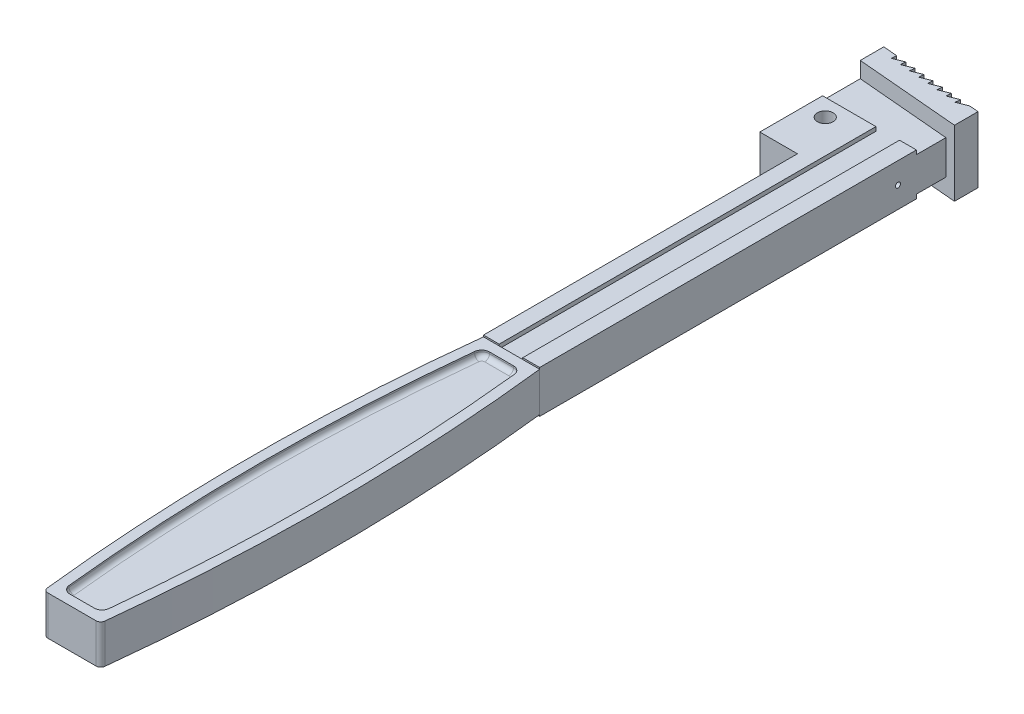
SolidWorks part; units mm, degrees
ref_plane "Front" through (0, 0, 0) normal (0, 0, 1) x (1, 0, 0)
ref_plane "Top" through (0, 0, 0) normal (0, 1, 0) x (1, 0, 0)
ref_plane "Right" through (0, 0, 0) normal (1, 0, 0) x (0, 0, -1)
sketch "Sketch1" plane through (0, 0, 0) normal (0, 1, 0) x (1, 0, 0)
  line L0 (-9, 0) -> (9, 0)
  line L1 (-8.9429, 140) -> (-8.9429, 240)
  line L2 (-8.9429, 140) -> (8.9429, 140) construction
  line L3 (-8.9429, 240) -> (-20.9429, 240)
  line L4 (-20.9429, 240) -> (-20.9429, 272)
  line L5 (-20.9429, 272) -> (8.9429, 269.3853)
  line L6 (8.9429, 269.3853) -> (8.9429, 140)
  arc A0 (-8.9429, 140) -> (-9, 0) centre (609.077, 69.748) ccw
  arc A1 (8.9429, 140) -> (9, 0) centre (-609.077, 69.748) cw
  point P3 (0, 140)
  dimension "D4" = 622
  dimension "D1" = 18
  dimension "D3" = 140
  dimension "D5" = 85
  dimension "D6" = 100
  dimension "D7" = 12
  dimension "D8" = 32
  dimension "D9" = 30
extrude "Boss-Extrude1" add sketch "Sketch1" along normal mid plane 12.5
sketch "Sketch2" plane through (0, 0, 0) normal (0, 1, 0) x (1, 0, 0)
  line L0 (-20.9429, 279.5) -> (11.9315, 276.6239)
  line L1 (-20.9429, 272) -> (-20.9429, 279.5)
  line L2 (11.9315, 276.6239) -> (11.9315, 269.1239)
  line L3 (-20.9429, 272) -> (11.9315, 269.1239)
  line L6 (-9, 0) -> (9, 0)
  line L7 (8.9429, 140) -> (8.9429, 269.3853)
  line L8 (8.9429, 269.3853) -> (-20.9429, 272)
  line L9 (-20.9429, 272) -> (-20.9429, 240)
  line L10 (-20.9429, 240) -> (-8.9429, 240)
  line L11 (-8.9429, 240) -> (-8.9429, 140)
  line L12 (-9, 0) -> (9, 0) construction
  line L13 (8.9429, 140) -> (8.9429, 269.3853) construction
  line L14 (8.9429, 269.3853) -> (-20.9429, 272) construction
  line L15 (-20.9429, 272) -> (-20.9429, 240) construction
  line L16 (-20.9429, 240) -> (-8.9429, 240) construction
  line L17 (-8.9429, 240) -> (-8.9429, 140) construction
  arc A2 (-8.9429, 140) -> (-9, 0) centre (609.077, 69.748) ccw
  arc A3 (9, 0) -> (8.9429, 140) centre (-609.077, 69.748) ccw
  arc A4 (-8.9429, 140) -> (-9, 0) centre (609.077, 69.748) ccw construction
  arc A5 (9, 0) -> (8.9429, 140) centre (-609.077, 69.748) ccw construction
  dimension "D2" = 33
  dimension "D3" = 7.5
  dimension "D1" = 0
extrude "Boss-Extrude2" add sketch "Sketch2" along normal mid plane 21
sketch "Sketch3" plane through (0, 10.5, 0) normal (0, 1, 0) x (1, 0, 0)
  line L0 (-16.46, 279.1078) -> (-16.5995, 277.5137)
  line L1 (11.9315, 276.6239) -> (-20.9429, 279.5) construction
  line L2 (-16.5995, 277.5137) -> (-13.2722, 278.8289)
  line L3 (-13.2722, 278.8289) -> (-16.46, 279.1078)
  dimension "D1" = 4.5
  dimension "D2" = 3.2
  dimension "D3" = 1.6002
extrude "Cut-Extrude1" cut sketch "Sketch3" against normal through all
pattern_linear "LPattern1" count 8 spacing 3.2 along (0.9962, 0, 0.0872) of "Cut-Extrude1"
sketch "Sketch4" plane through (0, 6.25, 0) normal (0, 1, 0) x (1, 0, 0)
  line L0 (-20.9429, 260) -> (8.9429, 260)
  line L1 (-20.9429, 272) -> (8.9429, 269.3853)
  line L2 (-20.9429, 272) -> (11.9315, 269.1239) construction
  line L3 (-20.9429, 240) -> (-8.9429, 240) construction
  line L4 (-20.9429, 272) -> (-20.9429, 260)
  line L5 (-20.9429, 272) -> (-20.9429, 240) construction
  line L6 (8.9429, 269.3853) -> (8.9429, 260)
  line L8 (8.9429, 140) -> (8.9429, 269.3853) construction
  dimension "D1" = 20
extrude "Cut-Extrude2" cut sketch "Sketch4" against normal blind 0.8
sketch "Sketch6" plane through (0, 6.25, 0) normal (0, 1, 0) x (1, 0, 0)
  line L0 (-8.9429, 140) -> (8.9429, 140) construction
  line L1 (3.5571, 260) -> (3.5571, 140)
  line L2 (-20.9429, 260) -> (8.9429, 260) construction
  line L3 (-3.9429, 260) -> (-3.9429, 140)
  line L4 (-3.9429, 260) -> (3.5571, 260)
  line L5 (-3.9429, 140) -> (3.5571, 140)
  line L6 (-8.9429, 240) -> (-8.9429, 140) construction
  dimension "D1" = 5
  dimension "D2" = 7.5
extrude "Cut-Extrude3" cut sketch "Sketch6" against normal blind 0.8
sketch "Sketch7" plane through (0, 6.25, 0) normal (0, 1, 0) x (1, 0, 0)
  line L7 (-6.1342, 3.2) -> (6.1342, 3.2)
  line L8 (-6.1342, 3.2) -> (6.1342, 3.2)
  line L10 (-3.9429, 136.8) -> (3.5571, 136.8)
  line L11 (-6.0794, 136.8) -> (6.0794, 136.8)
  arc A9 (6.1342, 3.2) -> (5.7634, 139.6386) centre (-609.077, 69.748) ccw
  arc A10 (-5.7634, 139.6386) -> (-6.1342, 3.2) centre (609.077, 69.748) ccw
  arc A11 (6.1342, 3.2) -> (6.0794, 136.8) centre (-609.077, 69.748) ccw
  arc A12 (-6.0794, 136.8) -> (-6.1342, 3.2) centre (609.077, 69.748) ccw
  dimension "D1" = 3.2
  dimension "D2" = 3.2
extrude "Cut-Extrude4" cut sketch "Sketch7" against normal blind 2
sketch "Sketch8" plane through (0, 6.25, 0) normal (0, 1, 0) x (1, 0, 0)
  line L0 (-8.9429, 140) -> (-3.9429, 140)
  line L1 (3.5571, 140) -> (8.9429, 140)
  line L10 (3.5571, 260) -> (3.5571, 140)
  line L11 (3.5571, 140) -> (-3.9429, 140)
  line L12 (-3.9429, 140) -> (-3.9429, 260)
  line L13 (-3.9429, 260) -> (-20.9429, 260)
  line L14 (-20.9429, 260) -> (-20.9429, 240)
  line L15 (-20.9429, 240) -> (-8.9429, 240)
  line L16 (-8.9429, 240) -> (-8.9429, 140)
  line L17 (-9, 0) -> (9, 0)
  line L18 (8.9429, 140) -> (8.9429, 260)
  line L19 (8.9429, 260) -> (3.5571, 260)
  line L20 (3.5571, 260) -> (3.5571, 140)
  line L22 (-3.9429, 140) -> (-3.9429, 260)
  line L23 (-3.9429, 260) -> (-20.9429, 260)
  line L24 (-20.9429, 260) -> (-20.9429, 240)
  line L25 (-20.9429, 240) -> (-8.9429, 240)
  line L26 (-8.9429, 240) -> (-8.9429, 140)
  line L28 (8.9429, 140) -> (8.9429, 260)
  line L29 (8.9429, 260) -> (3.5571, 260)
  arc A2 (-8.9429, 140) -> (-9, 0) centre (609.077, 69.748) ccw
  arc A3 (9, 0) -> (8.9429, 140) centre (-609.077, 69.748) ccw
  dimension "D1" = 0
extrude "Boss-Extrude3" add sketch "Sketch8" along normal blind 0.5
mirror "Mirror1" about plane through (0, 0, 0) normal (0, 1, 0) of "Cut-Extrude2", "Cut-Extrude3", "Cut-Extrude4", "Boss-Extrude3"
fillet "Fillet1" radius 2.5 4 edges at (6.1342, 5.25, -3.2) (6.0794, 5.25, -136.8) (-6.1342, 5.25, -3.2) (-6.0794, 5.25, -136.8)
fillet "Fillet2" radius 2.5 4 edges at (-6.0794, -5.25, -136.8) (6.1342, -5.25, -3.2) (-6.1342, -5.25, -3.2) (6.0794, -5.25, -136.8)
sketch "Sketch9" plane through (0, 6.75, 0) normal (0, 1, 0) x (1, 0, 0)
  line L0 (-20.9429, 260) -> (-20.9429, 240) construction
  line L1 (-20.9429, 260) -> (-3.9429, 260) construction
  circle A0 centre (-14.5929, 254.5) radius 2.5
  dimension "D1" = 5
  dimension "D2" = 6.35
  dimension "D3" = 5.5
extrude "Cut-Extrude5" cut sketch "Sketch9" against normal through all
sketch "Sketch10" plane through (8.9429, 0, 0) normal (1, 0, 0) x (0, 0, -1)
  line L0 (269.1239, 10.5) -> (269.1239, -10.5) construction
  circle A0 centre (254.1239, 0) radius 1
  dimension "D1" = 2
  dimension "D2" = 15
fillet "Fillet3" radius 1.5 16 edges at (-5.5056, 4.25, -136.158) (0, 4.25, -136.8) (5.5056, 4.25, -136.158) (9.7229, 4.25, -70.0024) (5.5593, 4.25, -3.8426) (0, 4.25, -3.2) (-5.5593, 4.25, -3.8426) (-5.5056, -4.25, -136.158) (0, -4.25, -136.8) (5.5056, -4.25, -136.158) (9.7229, -4.25, -70.0024) (5.5593, -4.25, -3.8426) (0, -4.25, -3.2) (-5.5593, -4.25, -3.8426) (-9.7229, 4.25, -70.0024) (-9.7229, -4.25, -70.0024)
fillet "Fillet4" radius 1.5 2 edges at (9, 0, 0) (-9, 0, 0)
sketch "Sketch11" plane through (-8.9429, 0, 0) normal (-1, 0, 0) x (0, 0, 1)
  line L0 (-240, 6.75) -> (-240, -6.75) construction
  line L2 (-240, 6.75) -> (-140, 6.75) construction
  circle A0 centre (-175, 0) radius 1
  dimension "D3" = 2
  dimension "D2" = 6.75
  dimension "D1" = 65
hole_wizard "M2x0.4 Tapped Hole1" positions "3DSketch1" profile "Sketch12" tap size "M2x0.4" standard "ANSI Metric"
sketch3d "3DSketch1"
  point P0 (8.9429, 0, -254.1239)
sketch "Sketch12" plane through (8.9429, 0, -254.1239) normal (0, 1, 0) x (0, 0, -1)
  line L0 (0, 0) -> (0, 5.6807)
  line L1 (0, 5.6807) -> (0.8, 5.2)
  line L2 (0.8, 5.2) -> (0.8, 0)
  line L5 (0.8, 0) -> (0, 0)
  line L10 (0, 5.6807) -> (-0.8, 5.2) construction
  line L11 (0, -6.35) -> (0, 107.95) construction
  dimension "Tap Drill Dia." = 1.6
  dimension "Tap Drill Depth" = 5.2
  dimension "Drill Angle" = 118
hole_wizard "M2x0.4 Tapped Hole2" positions "3DSketch2" profile "Sketch13" tap size "M2x0.4" standard "ANSI Metric"
sketch3d "3DSketch2"
  point P0 (-8.9429, 0, -175)
sketch "Sketch13" plane through (-8.9429, 0, -175) normal (0, 1, 0) x (0, 0, 1)
  line L0 (0, 0) -> (0, 5.6807)
  line L1 (0, 5.6807) -> (0.8, 5.2)
  line L2 (0.8, 5.2) -> (0.8, 0)
  line L5 (0.8, 0) -> (0, 0)
  line L10 (0, 5.6807) -> (-0.8, 5.2) construction
  line L11 (0, -6.35) -> (0, 107.95) construction
  dimension "Tap Drill Dia." = 1.6
  dimension "Tap Drill Depth" = 5.2
  dimension "Drill Angle" = 118
